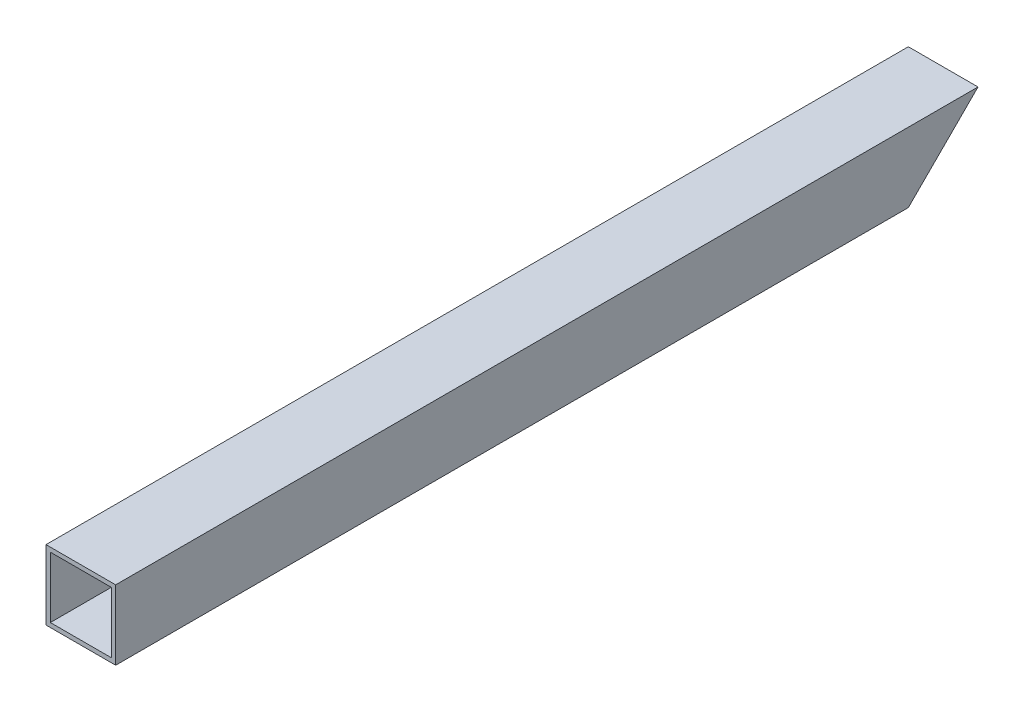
SolidWorks part; units mm, degrees
ref_plane "Front Plane" through (0, 0, 0) normal (0, 0, 1) x (1, 0, 0)
ref_plane "Top Plane" through (0, 0, 0) normal (0, 1, 0) x (1, 0, 0)
ref_plane "Right Plane" through (0, 0, 0) normal (1, 0, 0) x (0, 0, -1)
sketch "Sketch1" plane through (0, 0, 0) normal (0, 0, 1) x (1, 0, 0)
  line L0 (-22.225, -22.225) -> (-22.225, 22.225)
  line L1 (-25.4, -25.4) -> (25.4, -25.4)
  line L2 (-25.4, -25.4) -> (-25.4, 25.4)
  line L3 (-25.4, 25.4) -> (25.4, 25.4)
  line L4 (25.4, -25.4) -> (25.4, 25.4)
  line L5 (-22.225, 22.225) -> (22.225, 22.225)
  line L6 (22.225, -22.225) -> (22.225, 22.225)
  line L7 (-22.225, -22.225) -> (22.225, -22.225)
  dimension "D1" = 50.8
  dimension "D2" = 50.8
  dimension "D3" = 25.4
  dimension "D4" = 25.4
  dimension "D5" = 3.175
extrude "Boss-Extrude1" add sketch "Sketch1" against normal blind 628.8024
sketch "Sketch2" plane through (-25.4, 0, 0) normal (-1, 0, 0) x (0, 0, 1)
  line L0 (-628.8024, 25.4) -> (-578.0024, -25.4)
  line L1 (-628.8024, -25.4) -> (0, -25.4) construction
  line L2 (-628.8024, 25.4) -> (-628.8024, -25.4) construction
  dimension "D1" = 45
extrude "Cut-Extrude1" cut sketch "Sketch2" against normal through all and the other way through all flip side to cut
